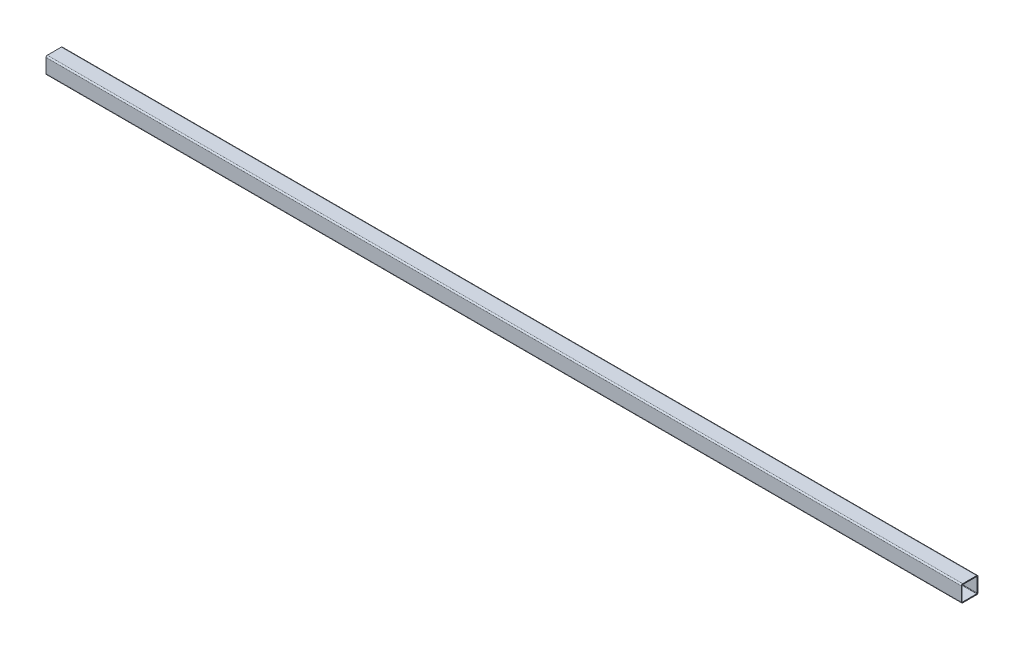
SolidWorks part; units mm, degrees
ref_plane "Front Plane" through (0, 0, 0) normal (0, 0, 1) x (1, 0, 0)
ref_plane "Top Plane" through (0, 0, 0) normal (0, 1, 0) x (1, 0, 0)
ref_plane "Right Plane" through (0, 0, 0) normal (1, 0, 0) x (0, 0, -1)
sketch "Sketch1" plane through (0, 0, 0) normal (1, 0, 0) x (0, 0, -1)
  line L0 (0, 2.54) -> (0, 29.21)
  line L1 (-2.54, 31.75) -> (-29.21, 31.75)
  line L2 (-31.75, 29.21) -> (-31.75, 2.54)
  line L3 (-29.21, 0) -> (-2.54, 0)
  line L4 (-1.651, 2.54) -> (-1.651, 29.21)
  line L5 (-2.54, 30.099) -> (-29.21, 30.099)
  line L6 (-30.099, 29.21) -> (-30.099, 2.54)
  line L7 (-29.21, 1.651) -> (-2.54, 1.651)
  arc A0 (-31.75, 2.54) -> (-29.21, 0) centre (-29.21, 2.54) ccw
  arc A1 (0, 2.54) -> (-2.54, 0) centre (-2.54, 2.54) cw
  arc A2 (0, 29.21) -> (-2.54, 31.75) centre (-2.54, 29.21) ccw
  arc A3 (-31.75, 29.21) -> (-29.21, 31.75) centre (-29.21, 29.21) cw
  arc A4 (-1.651, 29.21) -> (-2.54, 30.099) centre (-2.54, 29.21) ccw
  arc A5 (-30.099, 29.21) -> (-29.21, 30.099) centre (-29.21, 29.21) cw
  arc A6 (-30.099, 2.54) -> (-29.21, 1.651) centre (-29.21, 2.54) ccw
  arc A7 (-1.651, 2.54) -> (-2.54, 1.651) centre (-2.54, 2.54) cw
  point P12 (0, 0)
  point P15 (0, 31.75)
  point P18 (-31.75, 31.75)
  dimension "D3" = 2.54
  dimension "D1" = 31.75
  dimension "D2" = 31.75
  dimension "D4" = 1.651
extrude "Boss-Extrude1" add sketch "Sketch1" along normal blind 698.5
scale "Scale1" scale about centroid uniform scaling no x scale factor 1 y scale factor 0.4 z scale factor 0.4
